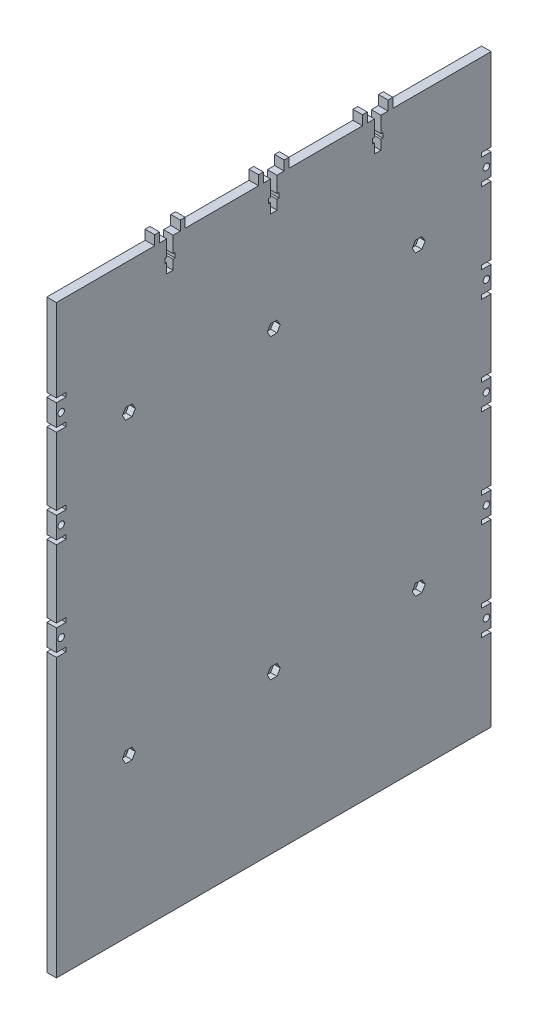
SolidWorks part; units mm, degrees
ref_plane "Front Plane" through (0, 0, 0) normal (0, 0, 1) x (1, 0, 0)
ref_plane "Top Plane" through (0, 0, 0) normal (0, 1, 0) x (1, 0, 0)
ref_plane "Right Plane" through (0, 0, 0) normal (1, 0, 0) x (0, 0, -1)
sketch "Sketch1" plane through (0, 0, 0) normal (1, 0, 0) x (0, 0, -1)
  line L0 (-136, -83) -> (136, -83) construction
  line L1 (136, -183) -> (-136, -183)
  line L2 (136, -183) -> (136, 183)
  line L3 (136, 183) -> (-136, 183)
  line L4 (-136, -183) -> (-136, 183)
  line L5 (136, -183) -> (-136, 183) construction
  line L6 (136, 183) -> (-136, -183) construction
  line L7 (-136, 67) -> (136, 67) construction
  point P0 (0, 0)
  dimension "D1" = 272
  dimension "D2" = 100
  dimension "D3" = 150
  dimension "D4" = 116
  dimension "D5" = 366
extrude "Boss-Extrude1" add sketch "Sketch1" along normal blind 6
sketch "Sketch2" plane through (6, 0, 0) normal (1, 0, 0) x (0, 0, -1)
  line L0 (-67, 183) -> (-63, 183)
  line L1 (136, 183) -> (-136, 183) construction
  line L2 (-63, 183) -> (-63, 173)
  line L3 (-63, 173) -> (-61.8, 173)
  line L4 (-61.8, 173) -> (-61.8, 170)
  line L5 (-61.8, 170) -> (-63, 170)
  line L6 (-63, 170) -> (-63, 164)
  line L7 (-63, 164) -> (-67, 164)
  line L8 (-67, 164) -> (-67, 170)
  line L9 (-67, 170) -> (-68.2, 170)
  line L10 (-68.2, 170) -> (-68.2, 173)
  line L11 (-68.2, 173) -> (-67, 173)
  line L12 (-67, 173) -> (-67, 183)
  line L13 (-136, 183) -> (-136, -183) construction
  point P12 (-65, 183)
  dimension "D1" = 4
  dimension "D2" = 10
  dimension "D3" = 6
  dimension "D4" = 3
  dimension "D5" = 6.4
  dimension "D6" = 71
extrude "Cut-Extrude1" cut sketch "Sketch2" against normal through all
sketch "Sketch3" plane through (6, 0, 0) normal (1, 0, 0) x (0, 0, -1)
  line L0 (-67, 183) -> (-136, 183) construction
  line L1 (-74.5, 183) -> (-71.5, 183)
  line L2 (-74.5, 183) -> (-74.5, 189)
  line L3 (-74.5, 189) -> (-71.5, 189)
  line L4 (-71.5, 183) -> (-71.5, 189)
  line L10 (-67, 164) -> (-63, 164) construction
  line L11 (-65, 164) -> (-65, 183) construction
  line L12 (-65, 183) -> (-67, 183) construction
  line L13 (-55.5, 189) -> (-58.5, 189)
  line L14 (-58.5, 183) -> (-58.5, 189)
  line L15 (-55.5, 183) -> (-58.5, 183)
  line L16 (-55.5, 183) -> (-55.5, 189)
  point P6 (-73, 189)
  point P9 (-65, 164)
  dimension "D1" = 3
  dimension "D2" = 6
  dimension "D3" = 8
extrude "Boss-Extrude2" add sketch "Sketch3" against normal through all
pattern_linear "LPattern1" count 3 spacing 65 along (0, 0, -1) of "Cut-Extrude1", "Boss-Extrude2"
sketch "Sketch4" plane through (6, 0, 0) normal (1, 0, 0) x (0, 0, -1)
  line L0 (-136, -183) -> (136, -183) construction
  line L1 (-136, 183) -> (-130, 183) construction
  line L2 (-136, 183) -> (-136, -183) construction
  line L3 (-136, -183) -> (-130, -183) construction
  line L4 (-130, 183) -> (-130, -183) construction
  line L5 (-133, 183) -> (-133, 122) construction
  line L6 (-133, 122) -> (-136, 122) construction
  line L7 (-130, 112.7) -> (-136, 112.7)
  line L8 (-130, 128.7) -> (-136, 128.7)
  line L9 (-130, 128.7) -> (-130, 131.3)
  line L10 (-130, 131.3) -> (-136, 131.3)
  line L11 (-136, 128.7) -> (-136, 131.3)
  line L12 (-130, 128.7) -> (-136, 131.3) construction
  line L13 (-130, 131.3) -> (-136, 128.7) construction
  line L14 (-136, 115.3) -> (-136, 112.7)
  line L15 (-130, 115.3) -> (-136, 115.3)
  line L16 (-130, 115.3) -> (-130, 112.7)
  line L17 (0, 0) -> (0, 164) construction
  line L18 (-2, 164) -> (2, 164) construction
  line L19 (-130, 67.7) -> (-130, 70.3)
  line L20 (-130, 67.7) -> (-136, 67.7)
  line L21 (-136, 67.7) -> (-136, 70.3)
  line L22 (-130, 70.3) -> (-136, 70.3)
  line L23 (-130, 51.7) -> (-136, 51.7)
  line L24 (-136, 54.3) -> (-136, 51.7)
  line L25 (-130, 54.3) -> (-136, 54.3)
  line L26 (-130, 54.3) -> (-130, 51.7)
  line L27 (-130, 6.7) -> (-130, 9.3)
  line L28 (-130, 6.7) -> (-136, 6.7)
  line L29 (-136, 6.7) -> (-136, 9.3)
  line L30 (-130, 9.3) -> (-136, 9.3)
  line L31 (-130, -9.3) -> (-136, -9.3)
  line L32 (-136, -6.7) -> (-136, -9.3)
  line L33 (-130, -6.7) -> (-136, -6.7)
  line L34 (-130, -6.7) -> (-130, -9.3)
  line L51 (-130, 128.7) -> (-130, 67.7) construction
  line L52 (130, 128.7) -> (130, 67.7) construction
  line L53 (130, 131.3) -> (136, 128.7) construction
  line L54 (130, 128.7) -> (136, 131.3) construction
  line L55 (133, 122) -> (136, 122) construction
  line L56 (130, -129.1) -> (130, -131.7)
  line L57 (130, -129.1) -> (136, -129.1)
  line L58 (136, -129.1) -> (136, -131.7)
  line L59 (130, -131.7) -> (136, -131.7)
  line L60 (130, -113.1) -> (136, -113.1)
  line L61 (136, -115.7) -> (136, -113.1)
  line L62 (130, -115.7) -> (136, -115.7)
  line L63 (130, -115.7) -> (130, -113.1)
  line L64 (130, -67.9) -> (130, -70.5)
  line L65 (130, -67.9) -> (136, -67.9)
  line L66 (136, -67.9) -> (136, -70.5)
  line L67 (130, -70.5) -> (136, -70.5)
  line L68 (130, -51.9) -> (136, -51.9)
  line L69 (136, -54.5) -> (136, -51.9)
  line L70 (130, -54.5) -> (136, -54.5)
  line L71 (130, -54.5) -> (130, -51.9)
  line L72 (130, -6.7) -> (130, -9.3)
  line L73 (130, -6.7) -> (136, -6.7)
  line L74 (136, -6.7) -> (136, -9.3)
  line L75 (130, -9.3) -> (136, -9.3)
  line L76 (130, 9.3) -> (136, 9.3)
  line L77 (136, 6.7) -> (136, 9.3)
  line L78 (130, 6.7) -> (136, 6.7)
  line L79 (130, 6.7) -> (130, 9.3)
  line L80 (130, 54.3) -> (130, 51.7)
  line L81 (130, 54.3) -> (136, 54.3)
  line L82 (136, 54.3) -> (136, 51.7)
  line L83 (130, 51.7) -> (136, 51.7)
  line L84 (130, 70.3) -> (136, 70.3)
  line L85 (136, 67.7) -> (136, 70.3)
  line L86 (130, 67.7) -> (136, 67.7)
  line L87 (130, 67.7) -> (130, 70.3)
  line L88 (130, 115.3) -> (130, 112.7)
  line L89 (130, 115.3) -> (136, 115.3)
  line L90 (136, 115.3) -> (136, 112.7)
  line L91 (136, 128.7) -> (136, 131.3)
  line L92 (130, 131.3) -> (136, 131.3)
  line L93 (130, 128.7) -> (130, 131.3)
  line L94 (130, 128.7) -> (136, 128.7)
  line L95 (130, 112.7) -> (136, 112.7)
  circle A0 centre (-133, 122) radius 2
  circle A1 centre (-133, 61) radius 2
  circle A2 centre (-133, 0) radius 2
  circle A5 centre (133, -122.4) radius 2
  circle A6 centre (133, -61.2) radius 2
  circle A7 centre (133, 0) radius 2
  circle A8 centre (133, 61) radius 2
  circle A9 centre (133, 122) radius 2
  point P11 (-133, 130)
  point P118 (133, 130)
extrude "Cut-Extrude2" cut sketch "Sketch4" against normal through all
sketch "Sketch5" [suppressed] plane through (0, 0, 0) normal (-1, 0, 0) x (0, 0, 1)
  line L0 (-136, 103) -> (136, 103) construction
  line L1 (-136, 70.3) -> (-136, 112.7) construction
  line L2 (136, 112.7) -> (136, 70.3) construction
  line L3 (-136, -83) -> (136, -83) construction
  line L4 (-136, -113.1) -> (-136, -70.5) construction
  line L6 (136, -183) -> (-136, -183) construction
  line L7 (136, -183) -> (-136, -183) construction
  line L8 (-90.6667, -85) -> (0, -85) construction
  line L9 (-136, -83) -> (-136, 103) construction
  line L10 (-90.6667, 101) -> (-90.6667, -85) construction
  line L12 (-90.6667, 101) -> (0, 101) construction
  line L14 (-92.6874, 104.5) -> (-94.7081, 101)
  line L15 (-94.7081, 101) -> (-92.6874, 97.5)
  line L16 (-92.6874, 97.5) -> (-88.6459, 97.5)
  line L17 (-88.6459, 97.5) -> (-86.6252, 101)
  line L18 (-86.6252, 101) -> (-88.6459, 104.5)
  line L19 (-88.6459, 104.5) -> (-92.6874, 104.5)
  line L20 (2.0207, 104.5) -> (-2.0207, 104.5)
  line L21 (-2.0207, 104.5) -> (-4.0415, 101)
  line L22 (-4.0415, 101) -> (-2.0207, 97.5)
  line L23 (-2.0207, 97.5) -> (2.0207, 97.5)
  line L24 (2.0207, 97.5) -> (4.0415, 101)
  line L25 (4.0415, 101) -> (2.0207, 104.5)
  line L26 (88.6459, 104.5) -> (86.6252, 101)
  line L27 (86.6252, 101) -> (88.6459, 97.5)
  line L28 (88.6459, 97.5) -> (92.6874, 97.5)
  line L29 (92.6874, 97.5) -> (94.7081, 101)
  line L30 (94.7081, 101) -> (92.6874, 104.5)
  line L31 (92.6874, 104.5) -> (88.6459, 104.5)
  line L32 (-92.6874, -81.5) -> (-94.7081, -85)
  line L33 (-94.7081, -85) -> (-92.6874, -88.5)
  line L34 (-92.6874, -88.5) -> (-88.6459, -88.5)
  line L35 (-88.6459, -88.5) -> (-86.6252, -85)
  line L36 (-86.6252, -85) -> (-88.6459, -81.5)
  line L37 (-88.6459, -81.5) -> (-92.6874, -81.5)
  line L38 (2.0207, -81.5) -> (-2.0207, -81.5)
  line L39 (-2.0207, -81.5) -> (-4.0415, -85)
  line L40 (-4.0415, -85) -> (-2.0207, -88.5)
  line L41 (-2.0207, -88.5) -> (2.0207, -88.5)
  line L42 (2.0207, -88.5) -> (4.0415, -85)
  line L43 (4.0415, -85) -> (2.0207, -81.5)
  line L44 (92.6874, -81.5) -> (88.6459, -81.5)
  line L45 (88.6459, -81.5) -> (86.6252, -85)
  line L46 (86.6252, -85) -> (88.6459, -88.5)
  line L47 (88.6459, -88.5) -> (92.6874, -88.5)
  line L48 (92.6874, -88.5) -> (94.7081, -85)
  line L49 (94.7081, -85) -> (92.6874, -81.5)
  circle A0 centre (-90.6667, -85) radius 2 construction
  circle A1 centre (0, -85) radius 2 construction
  circle A2 centre (90.6667, -85) radius 2 construction
  circle A3 centre (-90.6667, 101) radius 2 construction
  circle A4 centre (0, 101) radius 2 construction
  circle A5 centre (90.6667, 101) radius 2 construction
  circle A6 centre (-90.6667, 101) radius 3.5 construction
  circle A7 centre (0, 101) radius 3.5 construction
  circle A8 centre (90.6667, 101) radius 3.5 construction
  circle A9 centre (-90.6667, -85) radius 3.5 construction
  circle A10 centre (0, -85) radius 3.5 construction
  circle A11 centre (90.6667, -85) radius 3.5 construction
sketch "Sketch6" [suppressed] plane through (0, 0, 0) normal (-1, 0, 0) x (0, 0, 1)
  circle A0 centre (90.6667, 101) radius 2 construction
  circle A1 centre (0, 101) radius 2 construction
  circle A2 centre (-90.6667, 101) radius 2 construction
  circle A3 centre (90.6667, -85) radius 2 construction
  circle A4 centre (0, -85) radius 2 construction
  circle A5 centre (-90.6667, -85) radius 2 construction
  circle A6 centre (90.6667, 101) radius 2
  circle A7 centre (0, 101) radius 2
  circle A8 centre (-90.6667, 101) radius 2
  circle A9 centre (90.6667, -85) radius 2
  circle A10 centre (0, -85) radius 2
  circle A11 centre (-90.6667, -85) radius 2
extrude "Cut-Extrude3" [suppressed] cut sketch "Sketch6" against normal through all
extrude "Cut-Extrude4" [suppressed] cut sketch "Sketch5" against normal blind 4
sketch "Sketch7" plane through (6, 0, 0) normal (1, 0, 0) x (0, 0, -1)
  line L0 (-136, -83) -> (136, -83) construction
  line L2 (136, -113.1) -> (136, -70.5) construction
  line L3 (-136, 103) -> (136, 103) construction
  line L4 (-136, 112.7) -> (-136, 70.3) construction
  line L5 (136, 70.3) -> (136, 112.7) construction
  line L6 (-136, -183) -> (136, -183) construction
  line L7 (-90.6667, 101) -> (-90.6667, -85) construction
  line L8 (-136, -183) -> (136, -183) construction
  line L9 (-90.6667, 101) -> (0, 101) construction
  circle A0 centre (-90.6667, -85) radius 2
  circle A1 centre (-90.6667, 101) radius 2
  circle A2 centre (0, 101) radius 2
  circle A3 centre (0, -85) radius 2
  circle A4 centre (90.6667, 101) radius 2
  circle A5 centre (90.6667, -85) radius 2
extrude "Cut-Extrude5" cut sketch "Sketch7" against normal through all
sketch "Sketch8" plane through (6, 0, 0) normal (1, 0, 0) x (0, 0, -1)
  line L1 (-94.7081, 101) -> (-92.6874, 97.5)
  line L2 (-92.6874, 97.5) -> (-88.6459, 97.5)
  line L3 (-88.6459, 97.5) -> (-86.6252, 101)
  line L4 (-86.6252, 101) -> (-88.6459, 104.5)
  line L5 (-88.6459, 104.5) -> (-92.6874, 104.5)
  line L6 (-92.6874, 104.5) -> (-94.7081, 101)
  line L7 (-4.0415, 101) -> (-2.0207, 97.5)
  line L8 (-2.0207, 97.5) -> (2.0207, 97.5)
  line L9 (2.0207, 97.5) -> (4.0415, 101)
  line L10 (4.0415, 101) -> (2.0207, 104.5)
  line L11 (2.0207, 104.5) -> (-2.0207, 104.5)
  line L12 (-2.0207, 104.5) -> (-4.0415, 101)
  line L13 (86.6252, 101) -> (88.6459, 97.5)
  line L14 (88.6459, 97.5) -> (92.6874, 97.5)
  line L15 (92.6874, 97.5) -> (94.7081, 101)
  line L16 (94.7081, 101) -> (92.6874, 104.5)
  line L17 (92.6874, 104.5) -> (88.6459, 104.5)
  line L18 (88.6459, 104.5) -> (86.6252, 101)
  line L19 (86.6252, -85) -> (88.6459, -88.5)
  line L20 (88.6459, -88.5) -> (92.6874, -88.5)
  line L21 (92.6874, -88.5) -> (94.7081, -85)
  line L22 (94.7081, -85) -> (92.6874, -81.5)
  line L23 (92.6874, -81.5) -> (88.6459, -81.5)
  line L24 (88.6459, -81.5) -> (86.6252, -85)
  line L25 (-2.0207, -81.5) -> (-4.0415, -85)
  line L26 (-4.0415, -85) -> (-2.0207, -88.5)
  line L27 (-2.0207, -88.5) -> (2.0207, -88.5)
  line L28 (2.0207, -88.5) -> (4.0415, -85)
  line L29 (4.0415, -85) -> (2.0207, -81.5)
  line L30 (2.0207, -81.5) -> (-2.0207, -81.5)
  line L31 (-92.6874, -81.5) -> (-94.7081, -85)
  line L32 (-94.7081, -85) -> (-92.6874, -88.5)
  line L33 (-92.6874, -88.5) -> (-88.6459, -88.5)
  line L34 (-88.6459, -88.5) -> (-86.6252, -85)
  line L35 (-86.6252, -85) -> (-88.6459, -81.5)
  line L36 (-88.6459, -81.5) -> (-92.6874, -81.5)
  circle A0 centre (-90.6667, 101) radius 3.5 construction
  circle A1 centre (0, 101) radius 3.5 construction
  circle A2 centre (90.6667, 101) radius 3.5 construction
  circle A3 centre (90.6667, -85) radius 3.5 construction
  circle A4 centre (0, -85) radius 3.5 construction
  circle A5 centre (-90.6667, -85) radius 3.5 construction
  dimension "D1" = 7
extrude "Cut-Extrude6" cut sketch "Sketch8" against normal blind 4
equation "\"D6@Sketch4\" = \"D2@Sketch4\"/6"
equation "\"D5@Sketch5\"=(\"D4@Sketch5\"/3)/2"
equation "\"D6@Sketch5\"=\"D4@Sketch5\"/3"
equation "\"D8@Sketch5\"=\"D6@Sketch5\""
equation "\"D4@Sketch7\"=(\"D5@Sketch7\"/3)/2"
equation "\"D6@Sketch7\"=\"D5@Sketch7\"/3"
equation "\"D8@Sketch4\"=\"D6@Sketch4\"*2"
